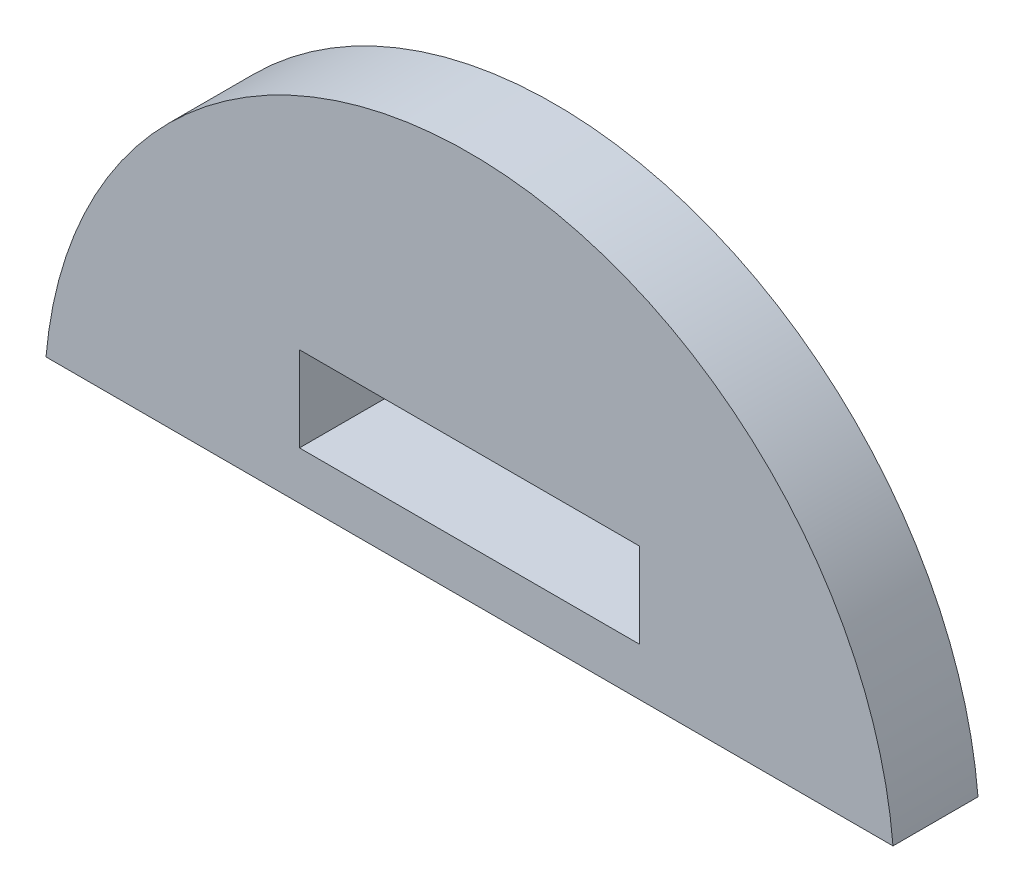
SolidWorks part; units mm, degrees
ref_plane "Front Plane" through (0, 0, 0) normal (0, 0, 1) x (1, 0, 0)
ref_plane "Top Plane" through (0, 0, 0) normal (0, 1, 0) x (1, 0, 0)
ref_plane "Right Plane" through (0, 0, 0) normal (1, 0, 0) x (0, 0, -1)
sketch "Sketch1" plane through (0, 0, 0) normal (0, 0, 1) x (1, 0, 0)
  line L0 (49.4622, 17.1594) -> (49.4622, -15.5834) construction
  line L6 (30.483, -0.9644) -> (68.4415, -0.9644)
  line L8 (41.8422, 4.9941) -> (57.0822, 4.9941)
  line L9 (41.8422, 4.9941) -> (41.8422, 1.1841)
  line L10 (41.8422, 1.1841) -> (57.0822, 1.1841)
  line L11 (57.0822, 4.9941) -> (57.0822, 1.1841)
  arc A2 (68.4415, -0.9644) -> (30.483, -0.9644) centre (49.4622, -2.6047) ccw
  dimension "D1" = 7.62
  dimension "D6" = 15.24
  dimension "D7" = 3.81
extrude "Extrude1" add sketch "Sketch1" along normal blind 3.81
